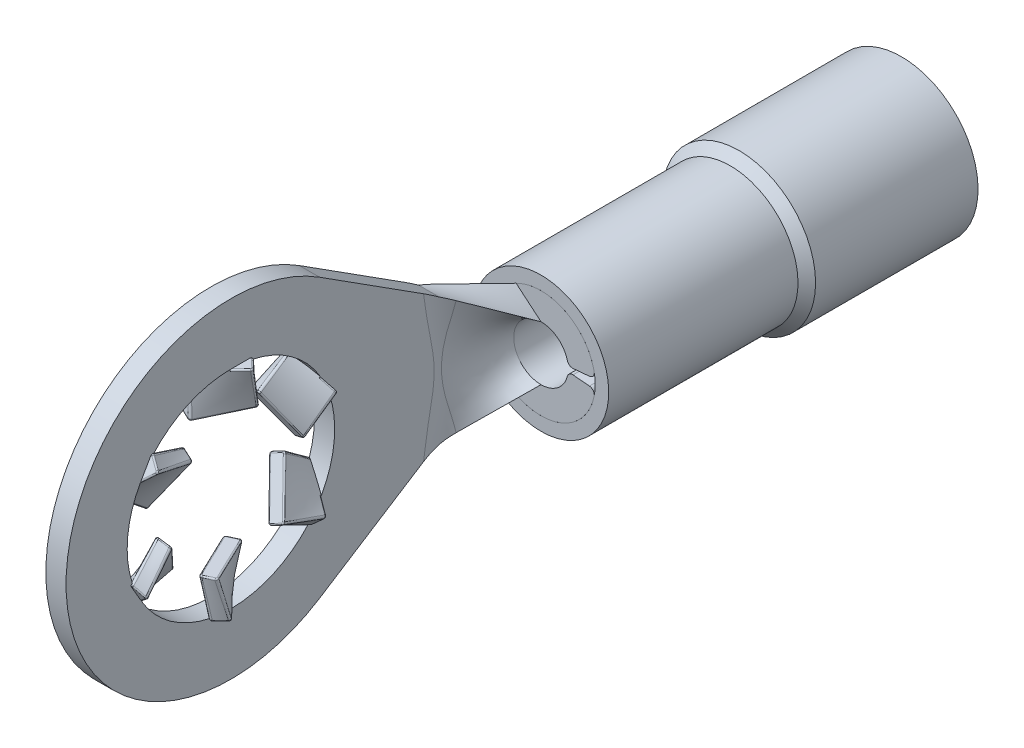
SolidWorks part; units mm, degrees
ref_plane "Front Plane" through (0, 0, 0) normal (0, 0, 1) x (1, 0, 0)
ref_plane "Top Plane" through (0, 0, 0) normal (0, 1, 0) x (1, 0, 0)
ref_plane "Right Plane" through (0, 0, 0) normal (1, 0, 0) x (0, 0, -1)
sketch "Sketch1" plane through (0, 0, 0) normal (1, 0, 0) x (0, 0, -1)
  line L0 (-11.43, 0) -> (11.43, 0) construction
  line L1 (11.43, -1.8415) -> (11.43, 1.8415) construction
  line L2 (-11.43, -4.7625) -> (-11.43, 4.7625) construction
  line L3 (-6.858, -1.8542) -> (-6.858, 1.8542) construction
  line L4 (1.016, -0.7874) -> (1.016, 0.7874) construction
  line L5 (-9.8552, 0) -> (-3.8608, 0) construction
  point P0 (-6.858, 0)
  point P3 (-6.858, 2.9972)
  point P4 (0, 0)
  point P8 (11.43, 0)
  point P9 (1.016, 0)
  point P12 (-6.858, 0)
  point P13 (-11.43, 0)
  point P18 (-6.858, 0)
  point P20 (1.016, 0)
  point P21 (0, 0)
  point P25 (-6.858, 0)
  point P26 (11.43, 0)
sketch "Sketch2" plane through (0, 0, 0) normal (1, 0, 0) x (0, 0, -1)
  line L0 (11.43, -4.7625) -> (11.43, 4.7625) construction
  line L1 (6.4834, 2.2098) -> (11.43, 2.2098)
  line L5 (6.4834, 2.2098) -> (6.4834, 1.9558)
  line L7 (1.016, 1.9558) -> (1.016, 0)
  line L8 (1.016, 0) -> (11.43, 0)
  line L11 (11.43, 2.2098) -> (11.43, 0)
  line L12 (6.4834, 1.9558) -> (1.016, 1.9558)
  point P4 (11.43, 0)
revolve "Revolve1" add sketch "Sketch2" angle 360 about L8
chamfer "Chamfer1" distance 0.254 angle 45 1 edges at (0, -2.2098, -6.4834)
sketch "Sketch3" plane through (0, 0, 0) normal (1, 0, 0) x (0, 0, -1)
  line L0 (11.43, 1.8415) -> (11.2814, 1.8415)
  line L2 (11.2814, 1.8415) -> (6.4834, 2.2098) construction
  line L3 (11.2814, 1.8415) -> (9.1364, 1.1684)
  line L4 (1.016, 0) -> (1.016, 0.7874)
  line L5 (1.016, 0.7874) -> (7.6829, 0.7874)
  line L6 (8.8824, 0) -> (6.4834, 0) construction
  line L7 (-11.43, 0) -> (11.43, 0) construction
  line L8 (9.1364, 1.1684) -> (8.8824, 1.1684)
  line L9 (8.8824, 1.1684) -> (7.6829, 0.7874)
  line L10 (1.016, 0) -> (11.43, 0)
  line L11 (11.43, 0) -> (11.43, 1.8415)
  point P5 (10.2089, 1.505)
  point P18 (7.6829, 0)
  point P23 (8.8824, 2.0257)
revolve "Cut-Revolve1" cut sketch "Sketch3" angle 360 about L10
sketch "Sketch4" plane through (0, 0, 0) normal (1, 0, 0) x (0, 0, -1)
  line L0 (9.1364, 0) -> (9.1364, 1.5653)
  line L1 (11.2814, 1.8415) -> (9.1364, 1.1684) construction
  line L2 (11.2814, 1.8415) -> (9.1364, 1.1684) construction
  line L3 (9.1364, 1.5653) -> (1.016, 1.5653)
  line L4 (1.016, 1.9558) -> (1.016, 0) construction
  line L5 (1.016, 1.5653) -> (1.016, 0)
  line L6 (1.016, 0) -> (9.1364, 0)
revolve "Cut-Revolve2" cut sketch "Sketch4" angle 360 about L6
sketch "Sketch5" plane through (0, 0, 0) normal (1, 0, 0) x (0, 0, -1)
  line L0 (9.1364, 0.7874) -> (9.1364, 1.5653)
  line L1 (9.1364, 0) -> (9.1364, 1.5653) construction
  line L4 (9.1364, 1.5653) -> (1.016, 1.5653) construction
  line L7 (9.1364, -1.5653) -> (9.1364, 1.5653) construction
  line L9 (9.1364, 1.5653) -> (1.016, 1.5653)
  line L10 (1.016, 1.5653) -> (1.016, 0.7874)
  line L11 (1.016, 0.7874) -> (9.1364, 0.7874)
  point P5 (9.1364, 0)
revolve "Revolve2" add sketch "Sketch5" angle 360 about L0
ref_plane "Plane1" through (-1.6669, 0, 0) normal (1, 0, 0) x (0, 0, -1)
sketch "Sketch6" plane through (-1.6669, 0, 0) normal (1, 0, 0) x (0, 0, -1)
  line L8 (-4.2969, 4.0152) -> (-0.889, 1.8415)
  line L17 (-4.2969, -4.0152) -> (-0.889, -1.8415)
  line L21 (-0.889, -1.8415) -> (-0.889, 1.8415)
  line L43 (-11.43, 0) -> (11.43, 0) construction
  line L46 (-9.8552, 0) -> (-3.8608, 0) construction
  arc A24 (-4.2969, 4.0152) -> (-4.2969, -4.0152) centre (-6.858, 0) ccw
  circle A32 centre (-6.858, 0) radius 2.9972
  point P52 (-0.889, 0)
extrude "Boss-Extrude1" add sketch "Sketch6" along normal blind 0.5842 separate body
sketch "Sketch7" plane through (0, 0, -1.016) normal (0, 0, 1) x (1, 0, 0)
  line L0 (-0.7187, 1.3905) -> (0, 0.7874)
  line L1 (-0.7187, -1.3905) -> (0, -0.7874)
  line L2 (0, -1.8415) -> (0, 1.8415) construction
  circle A1 centre (0, 0) radius 0.7874 construction
  circle A3 centre (0, 0) radius 0.7874 construction
  circle A4 centre (0, 0) radius 1.5653 construction
  dimension "D1" = 80
loft "Loft1" add
fillet "Fillet1" radius 1.27 2 edges at (-1.6669, 0, 0.889) (-1.0827, 0, 0.889)
sketch "Sketch8" plane through (0, 0, -1.016) normal (0, 0, 1) x (1, 0, 0)
  line L0 (0, 0) -> (1.5907, 0) construction
  line L1 (0, 0) -> (1.5907, 0.1392)
  line L2 (0, 0) -> (1.5907, -0.1392)
  line L3 (1.5907, 0.1392) -> (1.5907, -0.1392)
  point P6 (1.5907, 0)
extrude "Cut-Extrude1" cut sketch "Sketch8" against normal through all
fillet "Fillet2" radius 0.1524 4 edges at (0.7844, 0.0686, -5.0762) (0.7844, -0.0686, -5.0762) (1.5593, -0.1364, -5.0762) (1.5593, 0.1364, -5.0762)
ref_plane "Plane2" through (0, 1.8542, 0) normal (0, 1, 0) x (1, 0, 0)
ref_plane "Plane3" through (0, 2.9972, 0) normal (0, 1, 0) x (1, 0, 0)
sketch "Sketch11" plane through (0, 2.9972, 0) normal (0, 1, 0) x (1, 0, 0)
  line L0 (-1.6832, -7.493) -> (-0.7398, -6.5496)
  line L1 (-0.7398, -6.5496) -> (-1.0663, -6.223)
  line L2 (-1.0663, -6.223) -> (-2.0098, -7.1664)
  line L3 (-2.0098, -7.1664) -> (-1.6832, -7.493)
  line L5 (-1.0827, -6.858) -> (-1.6669, -6.858) construction
  line L6 (-1.0827, -9.8552) -> (-1.0827, -3.8608) construction
  line L7 (-1.6669, -3.8608) -> (-1.6669, -9.8552) construction
  line L8 (-1.8465, -7.3297) -> (-0.9031, -6.3863) construction
  line L9 (-1.2115, -7.0213) -> (-1.5381, -6.6947) construction
  point P14 (-1.3748, -6.858)
sketch "Sketch12" plane through (0, 1.8542, 0) normal (0, 1, 0) x (1, 0, 0)
  line L0 (-0.8668, -6.2509) -> (-1.5133, -7.6374)
  line L1 (-1.5133, -7.6374) -> (-1.8828, -7.4651)
  line L2 (-1.8828, -7.4651) -> (-1.2362, -6.0786)
  line L3 (-1.2362, -6.0786) -> (-0.8668, -6.2509)
  line L4 (-1.6832, -7.493) -> (-0.7398, -6.5496)
  line L5 (-0.7398, -6.5496) -> (-1.0663, -6.223)
  line L6 (-1.0663, -6.223) -> (-2.0098, -7.1664)
  line L7 (-2.0098, -7.1664) -> (-1.6832, -7.493)
  line L8 (-1.6832, -7.493) -> (-0.7398, -6.5496) construction
  line L9 (-0.7398, -6.5496) -> (-1.0663, -6.223) construction
  line L10 (-1.0663, -6.223) -> (-2.0098, -7.1664) construction
  line L11 (-2.0098, -7.1664) -> (-1.6832, -7.493) construction
  line L12 (-1.8465, -7.3297) -> (-0.9031, -6.3863) construction
  line L13 (-1.2115, -7.0213) -> (-1.5381, -6.6947) construction
  line L14 (-1.0515, -6.1647) -> (-1.698, -7.5513) construction
  point P6 (-1.3748, -6.858)
  point P12 (-1.3748, -6.858)
loft "Loft2" add profiles "Sketch11", "Sketch12"
fillet "Fillet6" radius 0.0381 8 edges
fillet "Fillet7" radius 0.0635 12 edges at (-1.2282, 1.8755, 6.089) (-1.9938, 2.9819, 7.177) (-1.8717, 1.8658, 7.45) (-1.5214, 1.8755, 7.627) (-0.8778, 1.8658, 6.266) (-0.7558, 2.9819, 6.539) (-1.6771, 2.9761, 7.4927) (-1.0724, 2.9761, 6.2233)
pattern_circular "CirPattern1" count 6 over 360 about axis through (-1.0827, 0, 6.858) along (-1, 0, 0) of "Loft2", "Fillet6", "Fillet7"
sketch "Sketch9" plane through (0, 0, 0) normal (1, 0, 0) x (0, 0, -1)
  line L0 (1.016, -1.5653) -> (9.1364, -1.5653) construction
  line L1 (1.016, -1.5653) -> (9.1364, -1.5653) construction
  line L3 (1.016, -0.7874) -> (9.1364, -0.7874) construction
  line L4 (1.016, -0.7874) -> (1.016, 0.7874) construction
  line L5 (11.43, -1.8415) -> (11.43, 1.8415) construction
  line L6 (-11.43, -4.7625) -> (-11.43, 4.7625) construction
  line L7 (-8.7122, 0) -> (-5.0038, 0)
  line L9 (-11.43, 0) -> (11.43, 0) construction
  line L10 (-9.8552, 0) -> (-3.8608, 0)
  point P3 (9.1364, -1.5653)
  point P5 (-11.43, 1.8415)
  point P6 (1.016, -0.7874)
  point P10 (11.43, 1.8415)
  point P23 (-6.858, 0)
  point P29 (-6.858, 0)
sketch "Sketch10" plane through (0, 0, 0) normal (0, 0, 1) x (1, 0, 0)
  line L0 (-2.0098, -4.7625) -> (-0.7398, -4.7625)
  line L1 (-1.0827, 4.7625) -> (-1.6669, 4.7625) construction
  circle A0 centre (0, 0) radius 0.7874 construction
  point P5 (-1.3748, 4.7625)
  point P6 (-1.6669, 4.7625)
  point P7 (-1.0827, 4.7625)
  point P10 (-1.3748, -4.7625)
equation "\"D1@Plane1\"=\"D1@Sketch5\"+.004"
equation "\"D2@Sketch5\"=\"Maximum Insulation Diameter@Sketch1\"*.85"
equation "\"D1@Sketch8\"  = \"D2@Sketch5\"/2+.001"
equation "\"D4@Sketch3\"=\"Maximum Insulation Diameter@Sketch1\"/2"
equation "\"D1@Sketch10\"=\"Barrel ID@Sketch1\""
equation "\"D1@Sketch4\"=\"Maximum Insulation Diameter@Sketch1\"*.85/2"
equation "\"D1@Sketch1\" = \"Spade Width@Sketch1\" * 0.48"
equation "\"D5@Sketch2\"=\"Insulation Length@Sketch1\" * 0.475"
equation "\"D1@Sketch6\" = \"Spade Width@Sketch1\""
equation "\"D2@Sketch6\" = \"Star Length@Sketch1\""
equation "\"D2@Sketch11\"=\"Grip Thickness@Sketch11\" / 2.75"
equation "\"D2@Sketch1\" = \"Star Length@Sketch1\" / 2"
equation "\"D2@Sketch12\" = \"D2@Sketch11\" * 0.8"
equation "\"D4@Sketch12\" = \"Grip Thickness@Sketch11\" * 0.8"
equation "\"D2@Sketch10\" = \"Grip Thickness@Sketch11\""
equation "\"D1@Sketch9\" = \"Stud Diameter@Sketch1\""
equation "\"D2@Sketch9\" = \"Star Length@Sketch1\""
equation "\"D1@Sketch2\"=(\"maximum insulation diameter@sketch1\"/2)*1.2"
